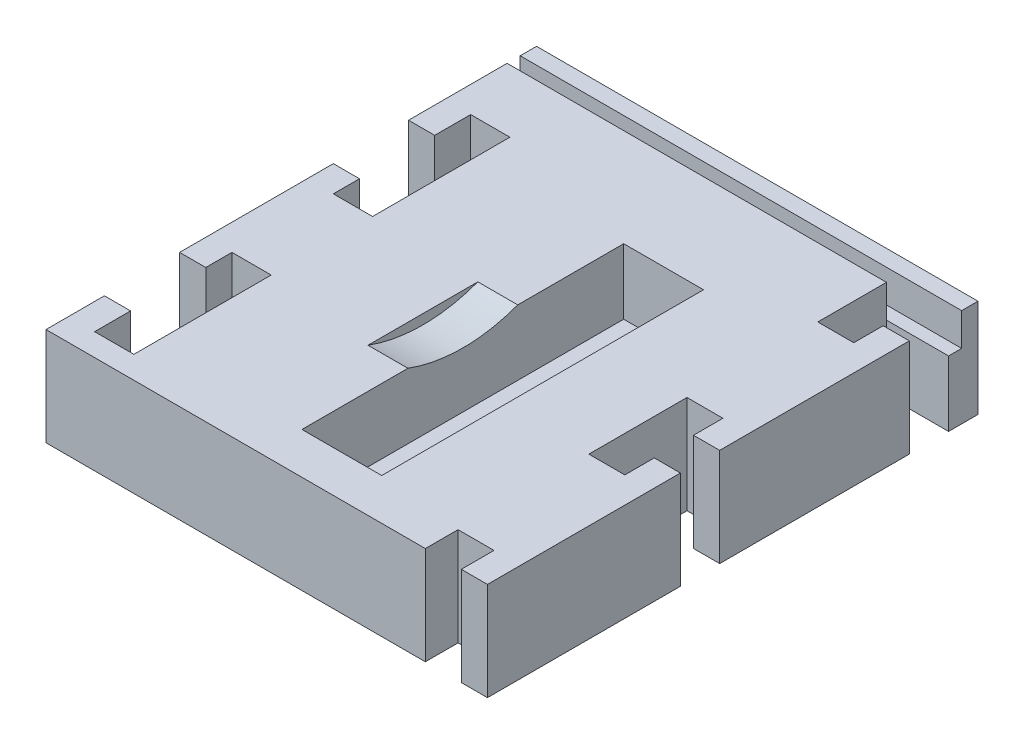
SolidWorks part; units mm, degrees
ref_plane "Front Plane" through (0, 0, 0) normal (0, 0, 1) x (1, 0, 0)
ref_plane "Top Plane" through (0, 0, 0) normal (0, 1, 0) x (1, 0, 0)
ref_plane "Right Plane" through (0, 0, 0) normal (1, 0, 0) x (0, 0, -1)
sketch "Sketch1" plane through (0, 0, 0) normal (0, 1, 0) x (1, 0, 0)
  line L1 (0, 0) -> (58, 0)
  line L2 (0, 0) -> (0, -140)
  line L3 (0, -140) -> (58, -140)
  line L4 (58, 0) -> (58, -140)
  dimension "D1" = 58
  dimension "D2" = 140
extrude "Boss-Extrude1" add sketch "Sketch1" along normal blind 15
sketch "Sketch4" plane through (0, 15, 0) normal (0, 1, 0) x (1, 0, 0)
  line L0 (44, -9.9705) -> (32.8, -9.9705)
  line L2 (44, -9.9705) -> (44, -78.1705)
  line L3 (44, -78.1705) -> (32.8, -78.1705)
  line L4 (32.8, -78.1705) -> (32.8, -9.9705)
  dimension "D1" = 68.2
  dimension "D2" = 11.2
extrude "Cut-Extrude2" cut sketch "Sketch4" against normal blind 10
sketch "Sketch6" plane through (32.8, 0, 0) normal (1, 0, 0) x (0, 0, -1)
  circle A0 centre (-44.0705, 37.59) radius 24.1
extrude "Cut-Extrude3" cut sketch "Sketch6" against normal blind 5.2
sketch "Sketch8" plane through (0, 15, 0) normal (0, 1, 0) x (1, 0, 0)
  line L0 (32.8, -78.1705) -> (32.8, -68.0705)
  line L3 (32.8, -52.4671) -> (32.8, -78.1705) construction
  line L4 (44, -78.1705) -> (44, -68.0705)
  line L5 (44, -78.1705) -> (44, -9.9705) construction
  line L6 (32.8, -68.0705) -> (44, -68.0705)
  line L7 (32.8, -78.1705) -> (44, -78.1705)
sketch "Sketch11" plane through (0, 15, 0) normal (0, 1, 0) x (1, 0, 0)
  line L0 (32.8, -78.1705) -> (32.8, -68.1705)
  line L1 (32.8, -52.4671) -> (32.8, -78.1705) construction
  line L2 (44, -78.1705) -> (44, -68.1705)
  line L3 (44, -78.1705) -> (44, -9.9705) construction
  line L4 (44, -68.1705) -> (32.8, -68.1705)
  line L5 (44, -78.1705) -> (32.8, -78.1705)
extrude "Boss-Extrude5" add sketch "Sketch11" against normal blind 15
extrude "Boss-Extrude2" add sketch "Sketch8" against normal blind 15
sketch "Sketch10" plane through (0, 5, 0) normal (0, 1, 0) x (1, 0, 0)
  line L0 (32.8, -9.9705) -> (32.8, -19.4705)
  line L1 (32.8, -9.9705) -> (32.8, -35.674) construction
  line L2 (44, -9.9705) -> (44, -19.4705)
  line L3 (44, -68.0705) -> (44, -9.9705) construction
  line L4 (44, -9.9705) -> (32.8, -9.9705)
  line L6 (32.8, -52.4671) -> (32.8, -35.674) construction
  line L7 (32.8, -44.0705) -> (44, -44.0705) construction
  line L9 (32.8, -19.4705) -> (44, -19.4705)
sketch "Sketch12" plane through (0, 15, 0) normal (0, 1, 0) x (1, 0, 0)
  line L0 (32.8, -9.9705) -> (32.8, -19.9705)
  line L1 (32.8, -9.9705) -> (32.8, -68.0705) construction
  line L2 (32.8, -19.9705) -> (44, -19.9705)
  line L3 (44, -68.0705) -> (44, -9.9705) construction
  line L4 (44, -19.9705) -> (44, -9.9705)
  line L5 (44, -9.9705) -> (32.8, -9.9705)
extrude "Boss-Extrude6" add sketch "Sketch12" against normal blind 15
sketch "Sketch13" plane through (0, 15, 0) normal (0, 1, 0) x (1, 0, 0)
  line L0 (32.8, -68.0705) -> (32.8, -69.0705)
  line L1 (44, -68.0705) -> (44, -69.0705)
  line L2 (44, -69.0705) -> (32.8, -69.0705)
  line L3 (44, -68.0705) -> (32.8, -68.0705)
extrude "Cut-Extrude5" cut sketch "Sketch13" against normal blind 10
sketch "Sketch14" plane through (0, 15, 0) normal (0, 1, 0) x (1, 0, 0)
  line L3 (44, -69.0705) -> (44, -19.9705) construction
  line L4 (44, -20.4205) -> (32.8, -20.4205)
  line L5 (32.8, -19.9705) -> (32.8, -35.674) construction
  line L6 (32.8, -20.4205) -> (32.8, -19.9705)
  line L7 (32.8, -19.9705) -> (44, -19.9705)
  line L8 (44, -19.9705) -> (44, -20.4205)
extrude "Boss-Extrude7" add sketch "Sketch14" against normal blind 15
sketch "Sketch15" plane through (0, 15, 0) normal (0, 1, 0) x (1, 0, 0)
  line L1 (44, -69.0705) -> (44, -20.4205) construction
  line L2 (44, -68.1791) -> (32.8, -68.1791)
  line L3 (32.8, -52.4671) -> (32.8, -69.0705) construction
  line L4 (32.8, -68.1791) -> (32.8, -69.0705)
  line L5 (32.8, -69.0705) -> (44, -69.0705)
  line L6 (44, -69.0705) -> (44, -68.1791)
extrude "Boss-Extrude8" add sketch "Sketch15" against normal blind 15
sketch "Sketch16" plane through (0, 15, 0) normal (0, 1, 0) x (1, 0, 0)
  line L0 (32.8, -68.1791) -> (32.8, -20.4205)
  line L1 (32.8, -20.4205) -> (44, -20.4205)
  line L2 (44, -20.4205) -> (44, -68.1791)
  line L3 (44, -68.1791) -> (32.8, -68.1791)
extrude "Boss-Extrude9" add sketch "Sketch16" against normal blind 15
sketch "Sketch17" plane through (0, 15, 0) normal (0, 1, 0) x (1, 0, 0)
  line L0 (32.8, -44.0705) -> (32.8, -19.4705)
  line L1 (32.8, -35.674) -> (32.8, -52.4671) construction
  line L2 (32.8, -44.0705) -> (32.8, -68.6705)
  line L3 (32.8, -68.6705) -> (45, -68.6705)
  line L4 (45, -19.4705) -> (45, -68.6705)
  line L5 (45, -19.4705) -> (32.8, -19.4705)
  line L6 (45, -19.4705) -> (45, -68.6705) construction
  line L7 (45, -44.0705) -> (0, -44.0705) construction
  line L8 (0, 0) -> (0, -140) construction
  dimension "D1" = 12.2
  dimension "D2" = 49.2
extrude "Cut-Extrude6" cut sketch "Sketch17" against normal blind 10
sketch "Sketch18" plane through (0, 15, 0) normal (0, 1, 0) x (1, 0, 0)
  line L0 (58, 0) -> (58, -85) construction
  line L1 (58, -140) -> (58, 0) construction
  line L2 (58, -70.0028) -> (58, -70) construction
  line L3 (58, -85) -> (67.5, -85)
  line L4 (58, -70) -> (58, -50.0028)
  line L5 (58, -70) -> (58, -70.0028)
  line L6 (63.5, -35) -> (63.5, -39.5)
  line L7 (67.5, -10.5) -> (67.5, -39.5)
  line L8 (67.5, -85) -> (67.5, -80.5)
  line L9 (58, -70.0028) -> (63.5, -70.0028)
  line L10 (58, -50.0028) -> (63.5, -50.0028)
  line L11 (67.5, -80.5) -> (58, -80.5)
  line L12 (63.5, -75.0028) -> (67.5, -75.0028)
  line L13 (58, -85) -> (58, -80.5)
  line L14 (67.5, -75.0028) -> (67.5, -45.5028)
  line L15 (63.5, -70.0028) -> (63.5, -75.0028)
  line L16 (63.5, -50.0028) -> (63.5, -45.5028)
  line L17 (67.5, -45.5028) -> (63.5, -45.5028)
  line L18 (58, -35) -> (58, -15)
  line L19 (58, -15) -> (63.5, -15)
  line L20 (63.5, -15) -> (63.5, -10.5)
  line L21 (63.5, -35) -> (58, -35)
  line L23 (63.5, -39.5) -> (67.5, -39.5)
  line L25 (67.5, -10.5) -> (63.5, -10.5)
  line L29 (58, 0) -> (67.5, 0)
  line L30 (67.5, 0) -> (67.5, -4.5)
  line L31 (67.5, -4.5) -> (67.5, -2.25)
  line L32 (67.5, -4.5) -> (58, -4.5)
  line L35 (58, -4.5) -> (58, 0)
  dimension "D1" = 29
  dimension "D2" = 4.5
  dimension "D3" = 4
extrude "Boss-Extrude10" add sketch "Sketch18" against normal blind 15
sketch "Croquis4" plane through (0, 15, 0) normal (0, 1, 0) x (1, 0, 0)
  line L0 (0, -85) -> (0, -140)
  line L1 (0, 0) -> (0, -140) construction
  line L2 (0, -85) -> (69.9169, -85)
  line L3 (0, -140) -> (69.9169, -140)
  line L4 (69.9169, -140) -> (69.9169, -85)
extrude "Cortar-Extruir3" cut sketch "Croquis4" against normal blind 15
extrude "Boss-Extrude4" add sketch "Sketch10" along normal blind 10
sketch "Sketch23" plane through (0, 15, 0) normal (0, 1, 0) x (1, 0, 0)
  line L0 (4, -29.5705) -> (0, -29.5705)
  line L1 (0, -19.5705) -> (0, -19.5705) construction
  line L2 (0, 0) -> (0, -85) construction
  line L3 (0, 0) -> (0, -85) construction
  line L4 (4, -14.0705) -> (10, -14.0705)
  line L5 (4, -19.5705) -> (0, -19.5705)
  line L6 (0, -66.0705) -> (0, -56.0714)
  line L7 (10, -14.0705) -> (10, -35.0705)
  line L8 (4, -29.5705) -> (4, -35.0705)
  line L10 (0, 0) -> (0, -85) construction
  line L11 (4, -35.0705) -> (10, -35.0705)
  line L12 (10, -50.5705) -> (4, -50.5705)
  line L13 (4, -66.0705) -> (0, -66.0705)
  line L14 (10, -50.5705) -> (10, -71.5705)
  line L15 (10, -71.5705) -> (4, -71.5705)
  line L16 (4, -66.0705) -> (4, -71.5705)
  line L17 (4, -14.0705) -> (4, -19.5705)
  line L18 (0, -56.0714) -> (4, -56.0714)
  line L19 (4, -56.0714) -> (4, -50.5705)
  line L21 (0, -19.5705) -> (0, -29.5705)
  dimension "D2" = 21
  dimension "D3" = 6
  dimension "D4" = 4
  dimension "D5" = 5.5
extrude "Cut-Extrude9" cut sketch "Sketch23" against normal blind 15
sketch "Sketch27" plane through (27.6, 0, 0) normal (1, 0, 0) x (0, 0, -1)
  line L0 (-52.4671, 15) -> (-35.674, 15)
  arc A2 (-52.4671, 15) -> (-35.674, 15) centre (-44.0705, 37.59) ccw
sketch "Croquis1" plane through (0, 15, 0) normal (0, 1, 0) x (1, 0, 0)
  line L0 (58, -50.0028) -> (58, -60.5)
  line L1 (58, -60.5) -> (63.5, -60.5)
  line L2 (63.5, -60.5) -> (63.5, -50.0028)
  line L3 (63.5, -50.0028) -> (58, -50.0028)
  line L4 (63.5, -45.5028) -> (67.5, -45.5028)
  line L5 (67.5, -45.5028) -> (67.5, -56.5)
  line L7 (67.5, -75.0028) -> (67.5, -45.5028) construction
  line L8 (63.5, -50.0028) -> (63.5, -45.5028) construction
  line L9 (63.5, -56.5) -> (63.5, -45.5028)
  line L10 (67.5, -56.5) -> (63.5, -56.5)
sketch "Croquis6" plane through (0, 15, 0) normal (0, 1, 0) x (1, 0, 0)
  line L0 (67.5, -4.5) -> (0, -4.5)
  line L1 (0, 0) -> (0, -19.5705) construction
  line L2 (0, -4.5) -> (0, -2.5)
  line L3 (0, -2.5) -> (67.5, -2.5)
  line L4 (67.5, 0) -> (67.5, -4.5) construction
  line L5 (67.5, -2.5) -> (67.5, -4.5)
  line L6 (67.5, -80.5) -> (0, -80.5)
  line L7 (0, -66.0705) -> (0, -85) construction
  line L8 (0, -80.5) -> (0, -82.5)
  line L9 (0, -82.5) -> (67.5, -82.5)
  line L10 (67.5, -85) -> (67.5, -80.5) construction
  line L11 (67.5, -82.5) -> (67.5, -80.5)
extrude "Cortar-Extruir4" cut sketch "Croquis6" against normal blind 5
sketch "Croquis7" plane through (0, 15, 0) normal (0, 1, 0) x (1, 0, 0)
  line L0 (0, -56.0714) -> (0, -54.5714)
  line L1 (0, -29.5705) -> (0, -56.0714) construction
  line L2 (0, -56.0714) -> (4, -56.0714)
  line L3 (4, -56.0714) -> (4, -54.5714)
  line L4 (4, -50.5705) -> (4, -56.0714) construction
  line L5 (4, -54.5714) -> (0, -54.5714)
  line L6 (0, -29.5705) -> (4, -29.5705)
  line L7 (4, -29.5705) -> (4, -31.0705)
  line L8 (4, -29.5705) -> (4, -35.0705) construction
  line L9 (4, -31.0705) -> (0, -31.0705)
  line L10 (0, -31.0705) -> (0, -29.5705)
extrude "Cortar-Extruir5" cut sketch "Croquis7" against normal blind 15
extrude "Cortar-Extruir1" cut sketch "Croquis1" against normal blind 15
extrude "Cut-Extrude10" cut sketch "Sketch27" against normal blind 0.9
sketch "Croquis2" plane through (0, 15, 0) normal (0, 1, 0) x (1, 0, 0)
  line L0 (0, -140) -> (67.5, -140)
  line L1 (0, -66.0705) -> (0, -80.5) construction
  line L2 (0, -75.0028) -> (67.5, -75.0028)
  line L3 (67.5, -140) -> (67.5, -75.0028)
  line L4 (0, -140) -> (0, -75.0028)
extrude "Cortar-Extruir2" cut sketch "Croquis2" against normal blind 15
sketch "Croquis3" plane through (0, 15, 0) normal (0, 1, 0) x (1, 0, 0)
  line L0 (58, -75.0028) -> (58, -80.5) construction
  line L1 (67.5, -80.5) -> (63.5, -80.5) construction
  line L2 (67.5, -75.0028) -> (67.5, -45.5028) construction
  line L3 (58, -75.0028) -> (67.5, -75.0028) construction
  line L4 (67.5, -75.0028) -> (67.5, -80.5) construction
  line L5 (67.5, -75.0028) -> (67.5, -80.5) construction
  line L6 (63.5, -70.0028) -> (63.5, -75.0028) construction
  line L7 (63.5, -80.5) -> (63.5, -76) construction
  line L8 (58, -75.0028) -> (58, -76) construction
  point P14 (0, 0)
